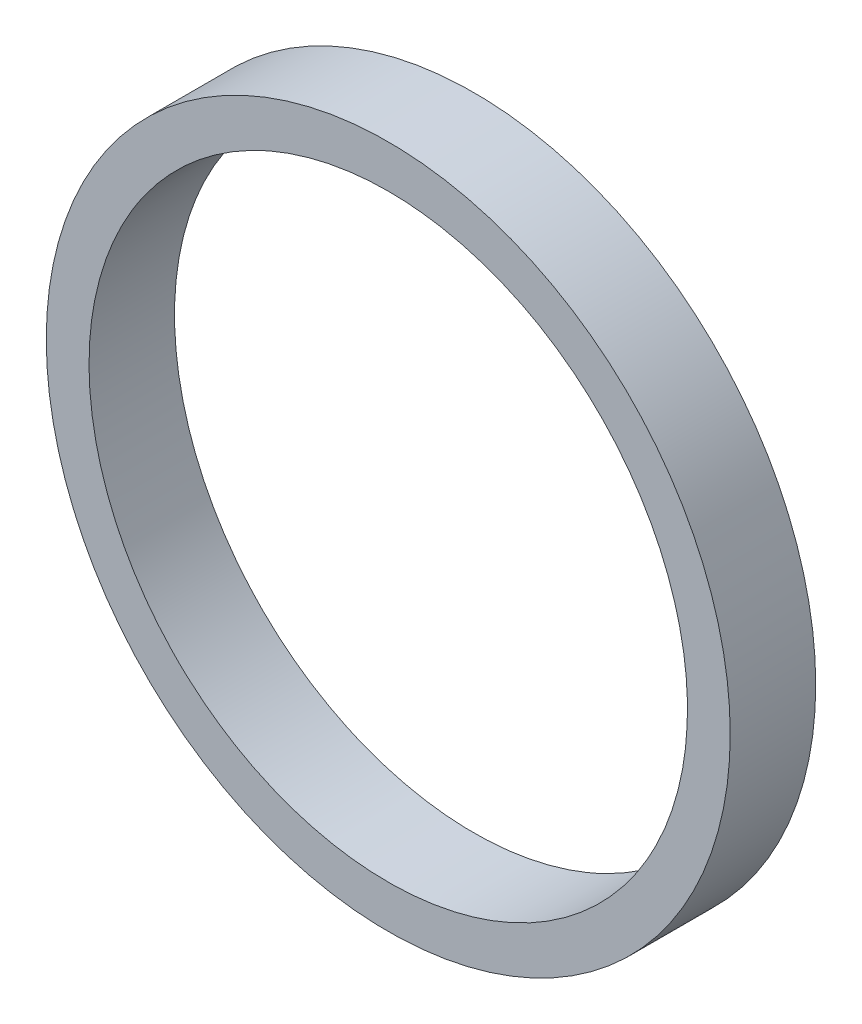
SolidWorks part; units mm, degrees
ref_plane "Front Plane" through (0, 0, 0) normal (0, 0, 1) x (1, 0, 0)
ref_plane "Top Plane" through (0, 0, 0) normal (0, 1, 0) x (1, 0, 0)
ref_plane "Right Plane" through (0, 0, 0) normal (1, 0, 0) x (0, 0, -1)
sketch "Sketch1" plane through (0, 0, 0) normal (0, 0, 1) x (1, 0, 0)
  circle A0 centre (0, 0) radius 40 construction
  circle A1 centre (0, 0) radius 40
  point P0 (0, 34.9989)
extrude "Extrude1" add sketch "Sketch1" along normal blind 10
